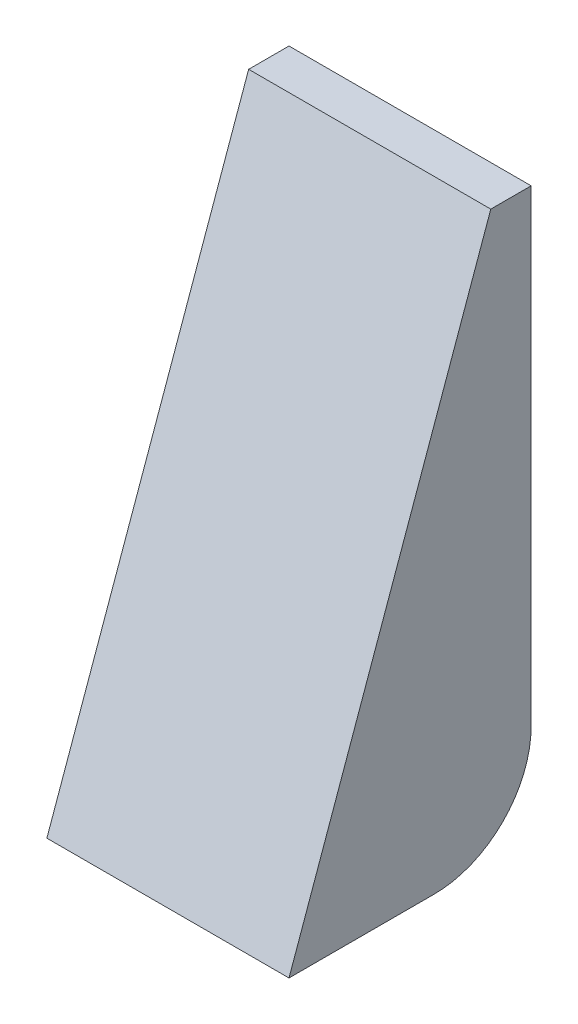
SolidWorks part; units mm, degrees
ref_plane "Front Plane" through (0, 0, 0) normal (0, 0, 1) x (1, 0, 0)
ref_plane "Top Plane" through (0, 0, 0) normal (0, 1, 0) x (1, 0, 0)
ref_plane "Right Plane" through (0, 0, 0) normal (1, 0, 0) x (0, 0, -1)
sketch "Sketch4" plane through (0, 0, 0) normal (0, 0, 1) x (1, 0, 0)
  line L1 (0, 0) -> (15, 0)
  line L2 (0, 0) -> (0, 35)
  line L3 (0, 35) -> (15, 35)
  line L4 (15, 0) -> (15, 35)
extrude "Boss-Extrude2" add sketch "Sketch4" along normal blind 15
ref_point "Point3" parameters "D1"=2.5
ref_point "Point4" parameters "D1"=2.5
ref_plane "Plane4" through (0, 4.7511, 13.3032) normal (0, -0.3363, -0.9417) x (-1, 0, 0)
sketch "Sketch5" plane through (0, 4.7511, 13.3032) normal (0, -0.3363, -0.9417) x (-1, 0, 0)
  line L1 (-15, -5.045) -> (0, -5.045)
  line L2 (-15, -5.045) -> (-15, 32.1201)
  line L3 (-15, 32.1201) -> (0, 32.1201)
  line L4 (0, -5.045) -> (0, 32.1201)
extrude "Cut-Extrude3" cut sketch "Sketch5" against normal through all
fillet "Fillet1" radius 6 1 edges at (7.5, 0, 0)
